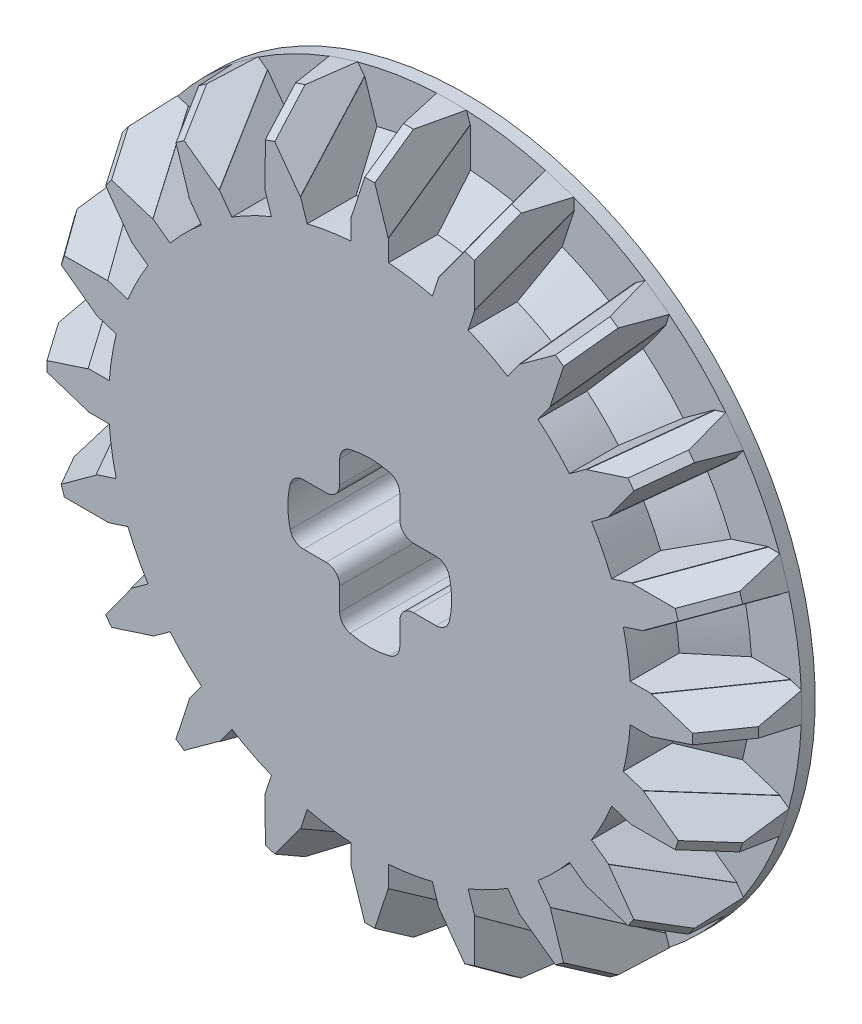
SolidWorks part; units mm, degrees
ref_plane "Front Plane" through (0, 0, 0) normal (0, 0, 1) x (1, 0, 0)
ref_plane "Top Plane" through (0, 0, 0) normal (0, 1, 0) x (1, 0, 0)
ref_plane "Right Plane" through (0, 0, 0) normal (1, 0, 0) x (0, 0, -1)
sketch "Sketch1" plane through (0, 0, 0) normal (0, 0, 1) x (1, 0, 0)
  circle A0 centre (0, 0) radius 10.25
  dimension "D1" = 20.5
extrude "Boss-Extrude1" add sketch "Sketch1" along normal blind 4
sketch "Sketch3" plane through (0, 0, 0) normal (0, 0, -1) x (-1, 0, 0)
  circle A0 centre (0, 0) radius 10.25
  circle A2 centre (0, 0) radius 3.25
  dimension "D1" = 20.5
  dimension "D3" = 6.5
extrude "Cut-Extrude1" cut sketch "Sketch3" against normal blind 1.2
sketch "Sketch4" plane through (0, 0, 0) normal (0, 1, 0) x (1, 0, 0)
  line L0 (10.25, -4) -> (7.65, -4)
  line L1 (-10.25, -4) -> (10.25, -4) construction
  line L2 (7.65, -4) -> (7.65, -2.5642)
  line L3 (7.65, -2.5642) -> (8.7991, -1.6)
  line L4 (8.7991, -1.6) -> (10.25, -1.6)
  line L5 (10.25, -4) -> (10.25, -1.2) construction
  line L6 (10.25, -4) -> (10.25, -1.6)
  dimension "D1" = 2.4
  dimension "D2" = 2.6
  dimension "D3" = 40
  dimension "D4" = 1.5
revolve "Cut-Revolve1" cut sketch "Sketch4" angle 360 about axis through (0, 0, 4) along (0, 0, -1)
sketch "Sketch5" plane through (0, 0, 4) normal (0, 0, 1) x (1, 0, 0)
  line L0 (-0.55, 7.6302) -> (-0.55, 10.25)
  line L1 (-0.55, 10.25) -> (0.55, 10.25)
  line L2 (0.55, 10.25) -> (0.55, 7.6302)
  line L3 (-0.55, 7.6302) -> (0.55, 7.6302)
  circle A0 centre (0, 0) radius 7.65 construction
  circle A1 centre (0, 0) radius 10.25 construction
  dimension "D1" = 0.55
  dimension "D2" = 1.1
extrude "Boss-Extrude2" add sketch "Sketch5" against normal up to surface (2.4 mm away)
sketch "Sketch7" plane through (-0.55, 0, 0) normal (-1, 0, 0) x (0, 0, 1)
  line L6 (4, 10.25) -> (4, 7.6302) construction
  line L8 (4, 10.25) -> (1.6, 10.25)
  line L11 (4, 8.25) -> (1.6, 9.9305)
  line L12 (1.6, 9.9305) -> (1.6, 10.25)
  line L13 (4, 8.25) -> (4, 10.25)
  dimension "D1" = 55
  dimension "D2" = 2
extrude "Cut-Extrude4" cut sketch "Sketch7" against normal blind 0.01
ref_plane "Plane1" through (0, 8.7572, 6.1319) normal (0, 0.8192, 0.5736) x (-1, 0, 0)
sketch "Sketch10" plane through (0, 8.7572, 6.1319) normal (0, 0.8192, 0.5736) x (-1, 0, 0)
  line L0 (-0.55, -4.5685) -> (-0.55, -2.6026) construction
  line L1 (-0.1537, -1.6885) -> (0.1463, -1.6885)
  line L2 (-0.1537, -1.6885) -> (-0.1537, -3.6885)
  line L3 (-0.1537, -3.6885) -> (0.1463, -3.6885)
  line L4 (0.1463, -1.6885) -> (0.1463, -3.6885)
  line L5 (-0.55, -4.5685) -> (0, -4.5685) construction
  point P4 (-0.0037, -3.6885)
  dimension "D1" = 0.3
  dimension "D2" = 0.5463
  dimension "D3" = 2
  dimension "D4" = 0.88
extrude "Cut-Extrude7" cut sketch "Sketch10" against normal blind 0.65
ref_plane "Plane4" through (-3.578, 1.1674, 0.8174) normal (-0.929, 0.3031, 0.2122) x (0.2046, -0.0572, 0.9772)
sketch "Sketch13" plane through (-3.578, 1.1674, 0.8174) normal (-0.929, 0.3031, 0.2122) x (0.2046, -0.0572, 0.9772)
  line L0 (3.326, 7.6458) -> (0.8846, 9.2656)
  line L1 (0.8846, 9.2656) -> (0.4586, 11.2517)
  line L2 (0.4586, 11.2517) -> (3.9965, 9.9885)
  line L3 (3.9965, 9.9885) -> (3.326, 7.6458)
extrude "Cut-Extrude12" cut sketch "Sketch13" along normal through all
ref_plane "Plane5" through (0, 0, 0) normal (1, 0, 0) x (0, 0, -1)
mirror "Mirror1" about plane through (0, 0, 0) normal (1, 0, 0) of "Cut-Extrude12", "Cut-Extrude4"
pattern_circular "CirPattern1" count 20 over 360 about axis through (0, 0, 0) along (0, 0, 1) of "Boss-Extrude2", "Cut-Extrude4", "Cut-Extrude7", "Cut-Extrude12", "Mirror1"
sketch "Sketch14" plane through (0, 0, 1.6) normal (0, 0, 1) x (1, 0, 0)
  circle A4 centre (0, 0) radius 10.25
  circle A5 centre (0, 0) radius 8.7991
  dimension "D1" = 20.5
  dimension "D2" = 17.5981
extrude "Boss-Extrude3" add sketch "Sketch14" against normal blind 0.3
sketch "Sketch15" plane through (0, 0, 0) normal (0, 0, -1) x (-1, 0, 0)
  circle A0 centre (0, 0) radius 7.5
  circle A1 centre (0, 0) radius 3.25
  dimension "D1" = 15
  dimension "D2" = 6.5
extrude "Cut-Extrude15" cut sketch "Sketch15" against normal blind 2
chamfer "Chamfer4" distance 0.8 angle 45 1 edges at (-7.5, 0, 1.2)
sketch "Sketch16" plane through (0, 0, 0) normal (0, 0, -1) x (-1, 0, 0)
  circle A0 centre (0, 0) radius 2.4
  dimension "D1" = 4.8
extrude "Cut-Extrude16" cut sketch "Sketch16" against normal blind 0.8
sketch "Sketch17" plane through (0, 0, 0.8) normal (0, 0, -1) x (-1, 0, 0)
  line L0 (-2.2328, -0.88) -> (-0.88, -0.88)
  line L2 (2.2328, 0.88) -> (0.88, 0.88)
  line L5 (0.88, -2.2328) -> (0.88, -0.88)
  line L6 (-0.88, -2.2328) -> (-0.88, -0.88)
  line L8 (-0.88, 0.88) -> (-0.88, 2.2328)
  line L9 (0.88, -0.88) -> (2.2328, -0.88)
  line L10 (-0.88, 0.88) -> (-2.2328, 0.88)
  line L11 (0.88, 0.88) -> (0.88, 2.2328)
  arc A0 (-2.2328, 0.88) -> (-2.2328, -0.88) centre (0, 0) ccw
  arc A1 (0.88, 2.2328) -> (-0.88, 2.2328) centre (0, 0) ccw
  arc A2 (2.2328, -0.88) -> (2.2328, 0.88) centre (0, 0) ccw
  arc A3 (-0.88, -2.2328) -> (0.88, -2.2328) centre (0, 0) ccw
  dimension "D1" = 4.8
  dimension "D2" = 1.76
  dimension "D3" = 1.76
  dimension "D4" = 0.88
  dimension "D5" = 0.88
extrude "Cut-Extrude17" cut sketch "Sketch17" against normal up to surface (3.2 mm away)
fillet "Fillet3" radius 0.4 12 edges at (-2.2328, 0.88, 2.4) (-0.88, 0.88, 2.4) (-0.88, 2.2328, 2.4) (0.88, 2.2328, 2.4) (0.88, 0.88, 2.4) (2.2328, 0.88, 2.4) (-2.2328, -0.88, 2.4) (-0.88, -0.88, 2.4) (-0.88, -2.2328, 2.4) (0.88, -2.2328, 2.4) (2.2328, -0.88, 2.4) (0.88, -0.88, 2.4)
